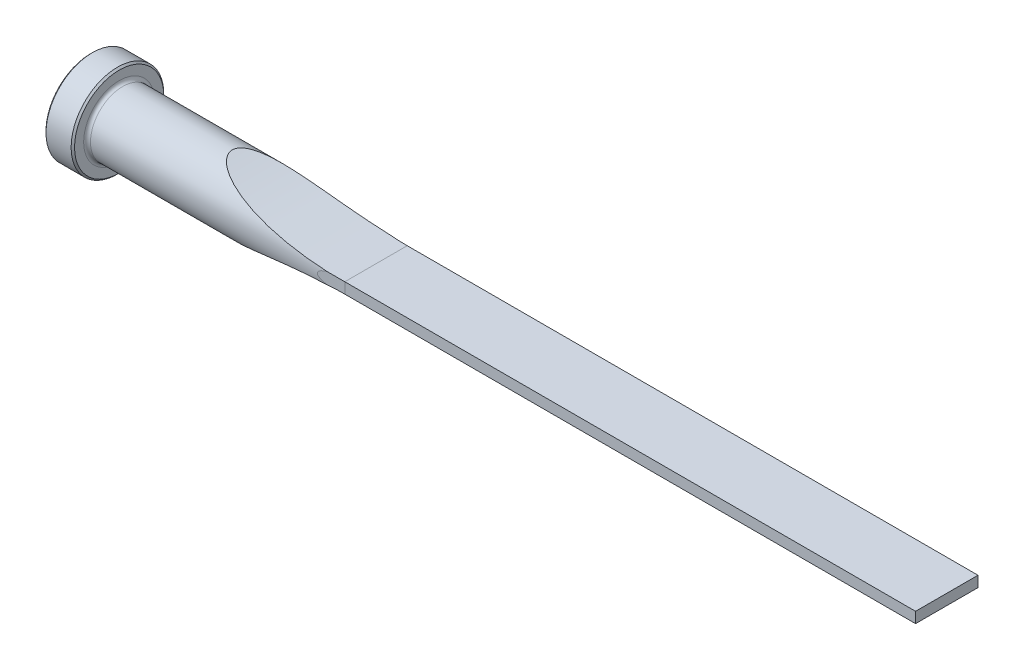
SolidWorks part; units mm, degrees
ref_plane "Front Plane" through (0, 0, 0) normal (0, 0, 1) x (1, 0, 0)
ref_plane "Top Plane" through (0, 0, 0) normal (0, 1, 0) x (1, 0, 0)
ref_plane "Right Plane" through (0, 0, 0) normal (1, 0, 0) x (0, 0, -1)
sketch "Sketch1" plane through (0, 0, 0) normal (0, 0, 1) x (1, 0, 0)
  line L0 (0, 0) -> (175.5286, 0) construction
  line L1 (0, 0) -> (0, 10.3124)
  line L2 (0, 10.3124) -> (6.35, 10.3124)
  line L3 (6.35, 10.3124) -> (6.35, 7.1437)
  line L4 (6.35, 7.1437) -> (190.5, 7.1437)
  line L5 (190.5, 7.1437) -> (190.5, 0)
  line L6 (190.5, 0) -> (0, 0)
  dimension "D1" = 190.5
  dimension "D2" = 20.6248
  dimension "D3" = 14.2875
  dimension "D4" = 6.35
revolve "Revolve1" add sketch "Sketch1" angle 360 about L0
sketch "Sketch2" plane through (0, 0, 0) normal (0, 0, 1) x (1, 0, 0)
  line L0 (190.5, 7.1437) -> (190.5, 1.1938)
  line L1 (190.5, -7.1437) -> (190.5, 7.1437) construction
  line L2 (190.5, 1.1938) -> (63.5, 1.1938)
  line L3 (190.5, 7.1437) -> (6.35, 7.1437) construction
  line L4 (31.5235, 7.1438) -> (190.5, 7.1437)
  line L5 (166.0833, 0) -> (153.1705, 0) construction
  arc A0 (63.5, 1.1938) -> (31.5235, 7.1438) centre (63.5, 90.0938) cw
  dimension "D1" = 88.9
  dimension "D3" = 127
  dimension "D2" = 2.3876
  dimension "D4" = 31.9765
extrude "Cut-Extrude1" cut sketch "Sketch2" against normal through all both and the other way through all
mirror "Mirror1" about plane through (0, 0, 0) normal (0, 1, 0) of "Cut-Extrude1"
sketch "Sketch3" plane through (0, 0, 0) normal (0, 1, 0) x (1, 0, 0)
  line L0 (190.5, 7.1437) -> (190.5, 6.9469)
  line L1 (190.5, 7.0433) -> (190.5, -7.0433) construction
  line L2 (190.5, 6.9469) -> (63.5, 6.9469)
  line L3 (190.5, 7.1437) -> (6.35, 7.1437) construction
  line L4 (57.5872, 7.1438) -> (190.5, 7.1437)
  line L5 (163.4716, 0) -> (166.2513, 0) construction
  line L6 (63.5, 7.0433) -> (63.5, -7.0433) construction
  arc A0 (63.5, 6.9469) -> (57.5872, 7.1438) centre (63.5, 95.8469) cw
  dimension "D2" = 88.9
  dimension "D1" = 13.8938
extrude "Cut-Extrude2" cut sketch "Sketch3" against normal through all both and the other way through all
mirror "Mirror2" about plane through (0, 0, 0) normal (0, 0, 1) of "Cut-Extrude2"
fillet "Fillet1" radius 0.762 1 edges at (6.35, 0, 7.1437)
chamfer "Chamfer1" distance 0.381 angle 45 2 edges at (0, 0, 10.3124) (6.35, 0, 10.3124)
